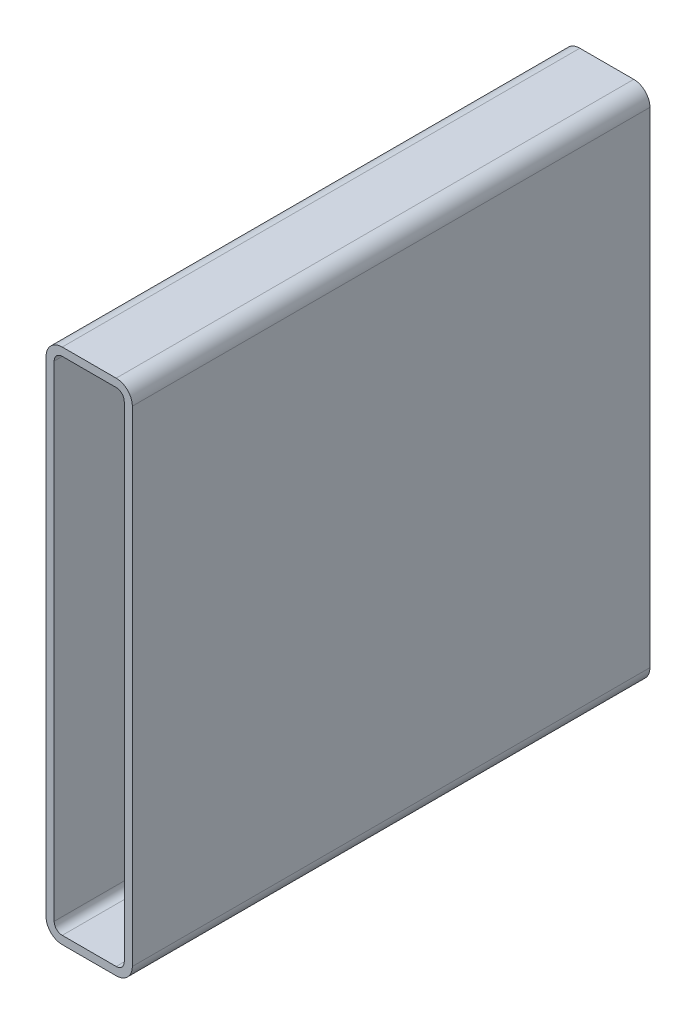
SolidWorks part; units mm, degrees
ref_plane "Front Plane" through (0, 0, 0) normal (0, 0, 1) x (1, 0, 0)
ref_plane "Top Plane" through (0, 0, 0) normal (0, 1, 0) x (1, 0, 0)
ref_plane "Right Plane" through (0, 0, 0) normal (1, 0, 0) x (0, 0, -1)
sketch "Sketch1" plane through (0, 0, 0) normal (0, 0, 1) x (1, 0, 0)
  line B0 (9.525, 304.8) -> (41.275, 304.8)
  arc B1 (50.8, 295.275) -> (41.275, 304.8) centre (41.275, 295.275) ccw
  line B2 (50.8, 295.275) -> (50.8, 9.525)
  arc B3 (41.275, 0) -> (50.8, 9.525) centre (41.275, 9.525) ccw
  line B4 (41.275, 0) -> (9.525, 0)
  arc B5 (0, 9.525) -> (9.525, 0) centre (9.525, 9.525) ccw
  line B6 (0, 9.525) -> (0, 295.275)
  arc B7 (9.525, 304.8) -> (0, 295.275) centre (9.525, 295.275) ccw
  line B8 (9.525, 300.0375) -> (41.275, 300.0375)
  arc B9 (46.0375, 295.275) -> (41.275, 300.0375) centre (41.275, 295.275) ccw
  line B10 (46.0375, 295.275) -> (46.0375, 9.525)
  arc B11 (41.275, 4.7625) -> (46.0375, 9.525) centre (41.275, 9.525) ccw
  line B12 (41.275, 4.7625) -> (9.525, 4.7625)
  arc B13 (4.7625, 9.525) -> (9.525, 4.7625) centre (9.525, 9.525) ccw
  line B14 (4.7625, 9.525) -> (4.7625, 295.275)
  arc B15 (9.525, 300.0375) -> (4.7625, 295.275) centre (9.525, 295.275) ccw
sketch_block_instance "HSS12x2x0.1875-1"
sketch_block "HSS12x2x0.1875"
extrude "Boss-Extrude1" add sketch "Sketch1" along normal blind 304.8
